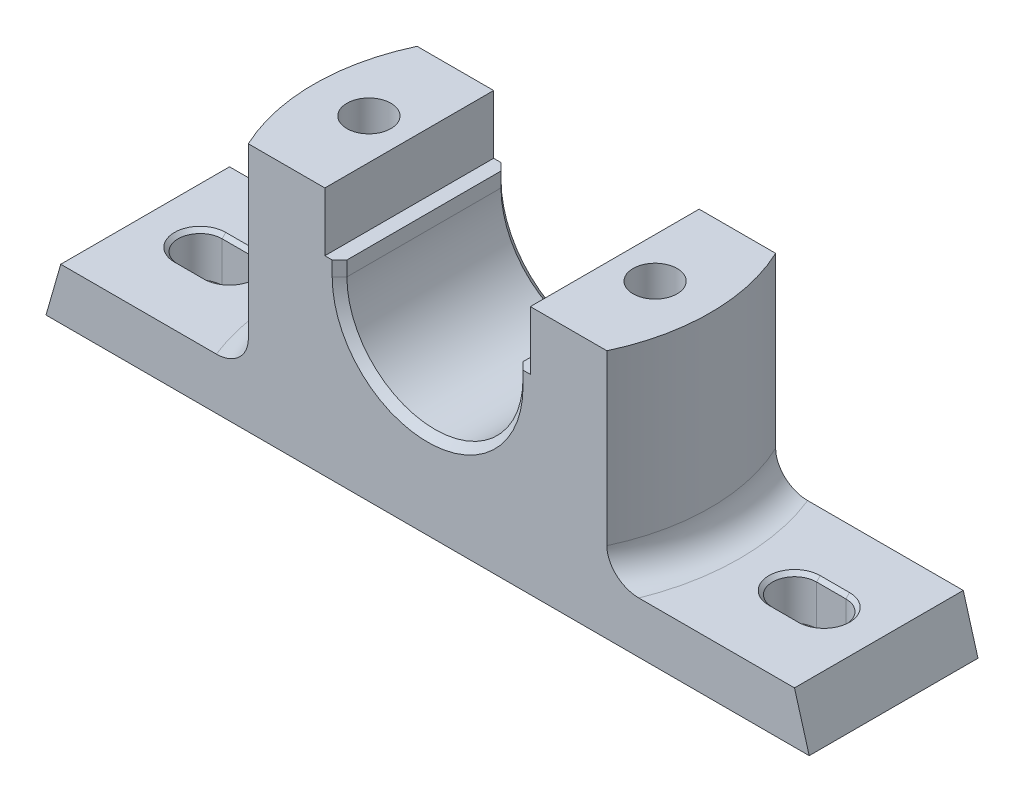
SolidWorks part; units mm, degrees
ref_plane "Front Plane" through (0, 0, 0) normal (0, 0, 1) x (1, 0, 0)
ref_plane "Top Plane" through (0, 0, 0) normal (0, 1, 0) x (1, 0, 0)
ref_plane "Right Plane" through (0, 0, 0) normal (1, 0, 0) x (0, 0, -1)
sketch "Sketch1" plane through (0, 0, 0) normal (0, 0, 1) x (1, 0, 0)
  line L0 (0, 117.1721) -> (0, 0) construction
  line L1 (-104, 0) -> (104, 0)
  line L2 (104, 0) -> (99.9856, 14)
  line L3 (-104, 0) -> (-99.9856, 14)
  line L4 (99.9856, 14) -> (54, 14)
  line L5 (-99.9856, 14) -> (-54, 14)
  line L6 (54, 14) -> (54, 68)
  line L7 (-54, 14) -> (-54, 68)
  line L8 (54, 68) -> (28, 68)
  line L9 (-54, 68) -> (-28, 68)
  line L10 (28, 68) -> (28, 52)
  line L11 (-28, 68) -> (-28, 52)
  line L12 (28, 52) -> (24, 52)
  line L13 (-28, 52) -> (-24, 52)
  line L14 (24, 52) -> (24, 48)
  line L15 (-24, 52) -> (-24, 48)
  arc A0 (24, 48) -> (0, 24) centre (0, 48) cw
  arc A1 (-24, 48) -> (0, 24) centre (0, 48) ccw
  dimension "D5" = 48
  dimension "D1" = 208
  dimension "D2" = 106
  dimension "D3" = 14
  dimension "D4" = 56
  dimension "D6" = 16
  dimension "D7" = 4
  dimension "D8" = 54
  dimension "D9" = 68
extrude "Boss-Extrude1" add sketch "Sketch1" along normal mid plane 46
sketch "Sketch2" plane through (0, 68, 0) normal (0, 1, 0) x (1, 0, 0)
  line L0 (-54, -23) -> (-54, 23) construction
  line L1 (-48.8569, 23) -> (48.8569, 23)
  line L2 (-48.8569, -23) -> (48.8569, -23)
  line L3 (-28, 23) -> (-54, 23) construction
  line L4 (-28, -23) -> (-54, -23) construction
  arc A0 (48.8569, -23) -> (48.8569, 23) centre (0, 0) ccw
  arc A1 (-48.8569, 23) -> (-48.8569, -23) centre (0, 0) ccw
extrude "Cut-Extrude1" cut sketch "Sketch2" against normal up to surface (54 mm away) flip side to cut
sketch "Sketch4" plane through (0, 0, 0) normal (0, -1, 0) x (1, 0, 0)
  line L1 (-97.5, -17.5) -> (97.5, -17.5)
  line L2 (-97.5, -17.5) -> (-97.5, 17.5)
  line L3 (-97.5, 17.5) -> (97.5, 17.5)
  line L4 (97.5, -17.5) -> (97.5, 17.5)
  line L5 (-97.5, -17.5) -> (97.5, 17.5) construction
  line L6 (-97.5, 17.5) -> (97.5, -17.5) construction
  point P0 (0, 0)
  dimension "D1" = 195
  dimension "D2" = 35
extrude "Cut-Extrude2" cut sketch "Sketch4" against normal blind 2
sketch "Sketch5" plane through (0, 2, 0) normal (0, -1, 0) x (1, 0, 0)
  line L1 (-52, 13) -> (-26, 13)
  line L2 (-52, 13) -> (-52, -13)
  line L3 (-52, -13) -> (-26, -13)
  line L4 (-26, 13) -> (-26, -13)
  line L5 (-52, 13) -> (-26, -13) construction
  line L6 (-52, -13) -> (-26, 13) construction
  line L7 (26, 13) -> (52, 13)
  line L8 (26, 13) -> (26, -13)
  line L9 (26, -13) -> (52, -13)
  line L10 (52, 13) -> (52, -13)
  line L11 (26, 13) -> (52, -13) construction
  line L12 (26, -13) -> (52, 13) construction
  point P0 (-39, 0)
  point P5 (39, 0)
  dimension "D1" = 78
  dimension "D2" = 39
  dimension "D3" = 26
extrude "Cut-Extrude3" cut sketch "Sketch5" against normal blind 10
other "Hole1"
sketch "Sketch7" plane through (0, 68, 0) normal (0, 1, 0) x (-1, 0, 0)
  circle A0 centre (39, 0) radius 6
  dimension "D1" = 12
  dimension "D2" = 39
other "Hole2"
sketch "Sketch8" plane through (0, 68, 0) normal (0, 1, 0) x (-1, 0, 0)
  circle A0 centre (-39, 0) radius 6
  dimension "D1" = 12
  dimension "D2" = 39
sketch "Sketch9" plane through (0, 14, 0) normal (0, 1, 0) x (1, 0, 0)
  line L0 (-85, 0) -> (-77, 0) construction
  line L1 (-85, 6) -> (-77, 6)
  line L2 (-85, -6) -> (-77, -6)
  line L3 (77, 0) -> (85, 0) construction
  line L4 (77, 6) -> (85, 6)
  line L5 (77, -6) -> (85, -6)
  arc A0 (-85, 6) -> (-85, -6) centre (-85, 0) ccw
  arc A1 (-77, -6) -> (-77, 6) centre (-77, 0) ccw
  arc A2 (77, 6) -> (77, -6) centre (77, 0) ccw
  arc A3 (85, -6) -> (85, 6) centre (85, 0) ccw
  point P3 (-81, 0)
  point P8 (81, 0)
  dimension "D4" = 6
  dimension "D1" = 8
  dimension "D2" = 154
  dimension "D3" = 77
extrude "Cut-Extrude4" cut sketch "Sketch9" against normal up to next
fillet "Fillet1" radius 8 2 edges at (-54, 14, 0) (54, 14, 0)
chamfer "Chamfer1" distance 1 angle 45 8 edges at (-71, 14, 0) (-81, 14, -6) (-81, 14, 6) (-91, 14, 0) (91, 14, 0) (81, 14, -6) (81, 14, 6) (71, 14, 0)
chamfer "Chamfer2" distance 2 angle 45 8 edges at (24, 50, -23) (24, 52, 0) (24, 50, 23) (0, 24, -23) (0, 24, 23) (-24, 50, -23) (-24, 50, 23) (-24, 52, 0)
